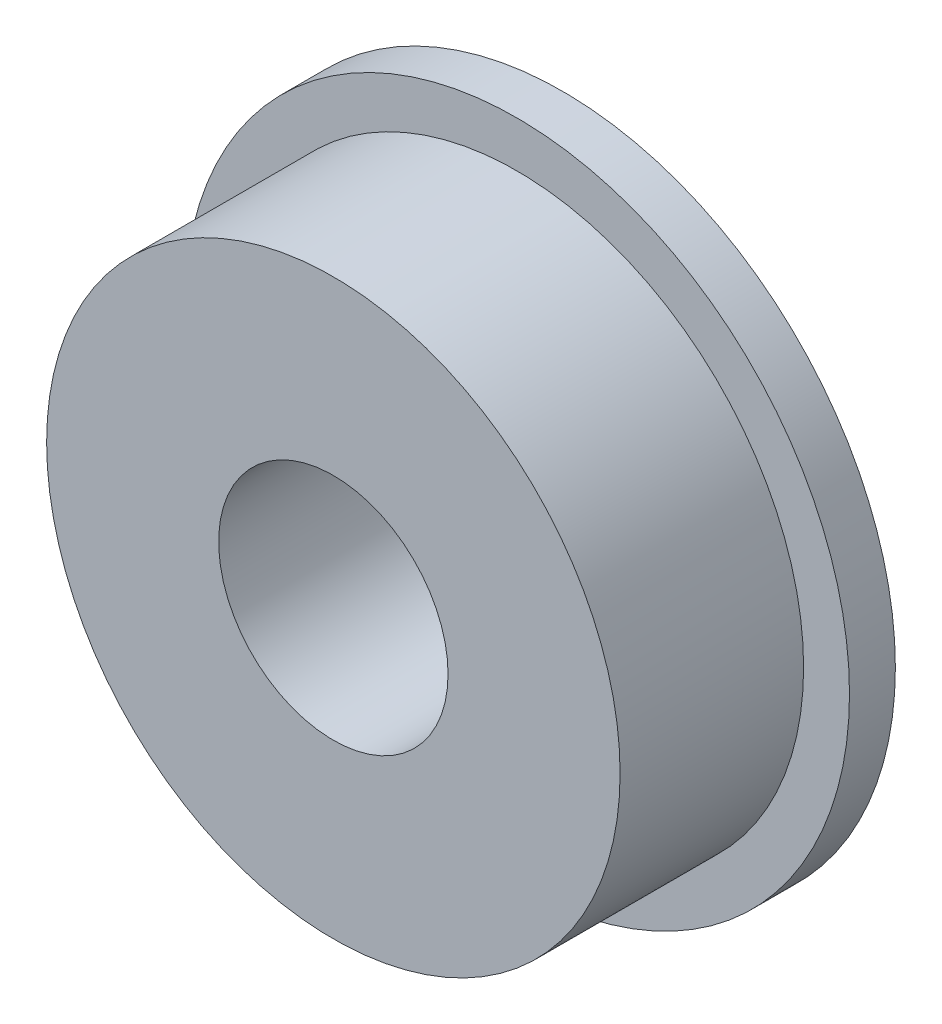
SolidWorks part; units mm, degrees
ref_plane "Front" through (0, 0, 0) normal (0, 0, 1) x (1, 0, 0)
ref_plane "Top" through (0, 0, 0) normal (0, 1, 0) x (1, 0, 0)
ref_plane "Right" through (0, 0, 0) normal (1, 0, 0) x (0, 0, -1)
sketch "Sketch1" plane through (0, 0, 0) normal (0, 0, 1) x (1, 0, 0)
  circle A0 centre (0, 0) radius 5.8
  circle A1 centre (0, 0) radius 2
  dimension "D1" = 11.6
  dimension "D2" = 4
extrude "Extrude1" add sketch "Sketch1" along normal blind 4
sketch "Sketch2" plane through (0, 0, 4) normal (0, 0, 1) x (1, 0, 0)
  circle A0 centre (0, 0) radius 5
  dimension "D1" = 10
extrude "Cut-Extrude1" cut sketch "Sketch2" against normal offset from surface (3.2 mm away) 0.8 flip side to cut
